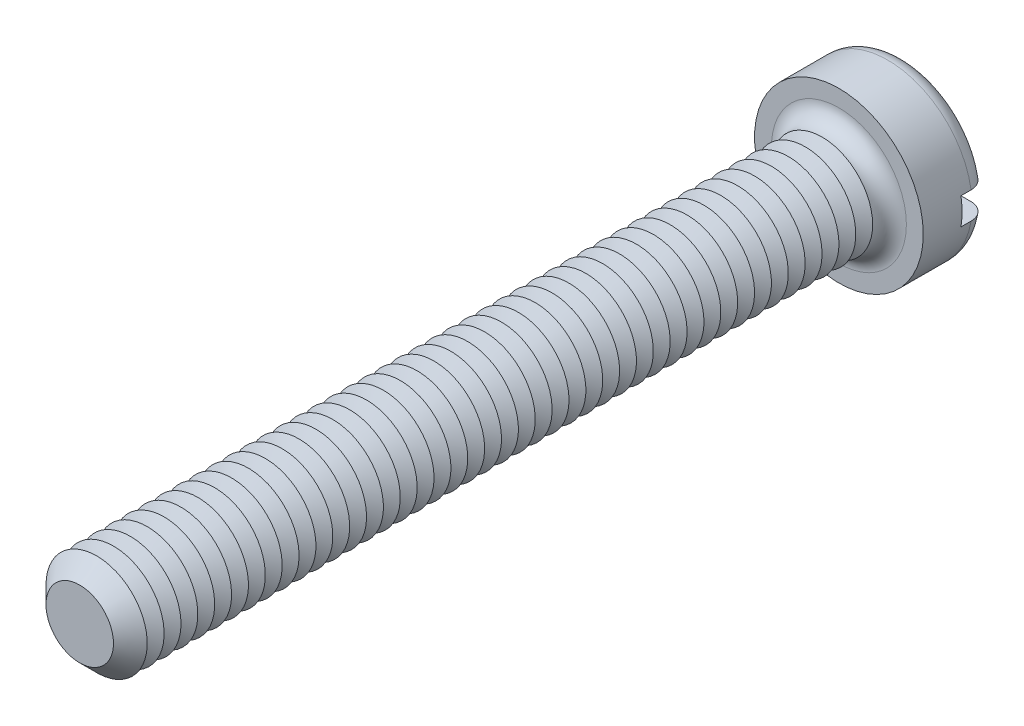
SolidWorks part; units mm, degrees
ref_plane "Front Plane" through (0, 0, 0) normal (0, 0, 1) x (1, 0, 0)
ref_plane "Top Plane" through (0, 0, 0) normal (0, 1, 0) x (1, 0, 0)
ref_plane "Right Plane" through (0, 0, 0) normal (1, 0, 0) x (0, 0, -1)
sketch "Sketch3" plane through (0, 0, 0) normal (0, 0, 1) x (1, 0, 0)
  circle A0 centre (0, 0) radius 5
  dimension "D1" = 10
extrude "Boss-Extrude2" add sketch "Sketch3" against normal blind 3.9
sketch "Sketch4" plane through (0, 0, 0) normal (0, 0, 1) x (1, 0, 0)
  circle A0 centre (0, 0) radius 3
  dimension "D1" = 6
extrude "Boss-Extrude3" add sketch "Sketch4" along normal blind 45
fillet "Fillet1" radius 1 2 edges at (5, 0, -3.9) (3, 0, 0)
chamfer "Chamfer1" distance 1 angle 45 1 edges at (3, 0, 45)
sketch "Sketch5" plane through (0, 0, 0) normal (1, 0, 0) x (0, 0, -1)
  line L0 (1.6944, 0) -> (-7.6738, 0) construction
sketch "Sketch6" plane through (0, 0, 0) normal (1, 0, 0) x (0, 0, -1)
  line L0 (-1, 3) -> (-1.5, 2.134)
  line L1 (-1.5, 2.134) -> (-2, 3)
  line L2 (-1, 3) -> (-44, 3) construction
  line L3 (-2, 3) -> (-1, 3)
  dimension "D1" = 1
revolve "Cut-Revolve1" cut sketch "Sketch6" angle 360 about L0
pattern_linear "LPattern1" count 43 spacing 1 along (0, 0, 1) of "Cut-Revolve1"
sketch "Sketch8" plane through (0, 0, -3.9) normal (0, 0, -1) x (-1, 0, 0)
  line L1 (5, -0.8) -> (-5, -0.8)
  line L2 (5, -0.8) -> (5, 0.8)
  line L3 (5, 0.8) -> (-5, 0.8)
  line L4 (-5, -0.8) -> (-5, 0.8)
  line L5 (5, -0.8) -> (-5, 0.8) construction
  line L6 (5, 0.8) -> (-5, -0.8) construction
  point P0 (0, 0)
  dimension "D1" = 10
  dimension "D2" = 1.6
extrude "Cut-Extrude1" cut sketch "Sketch8" against normal blind 1.6
